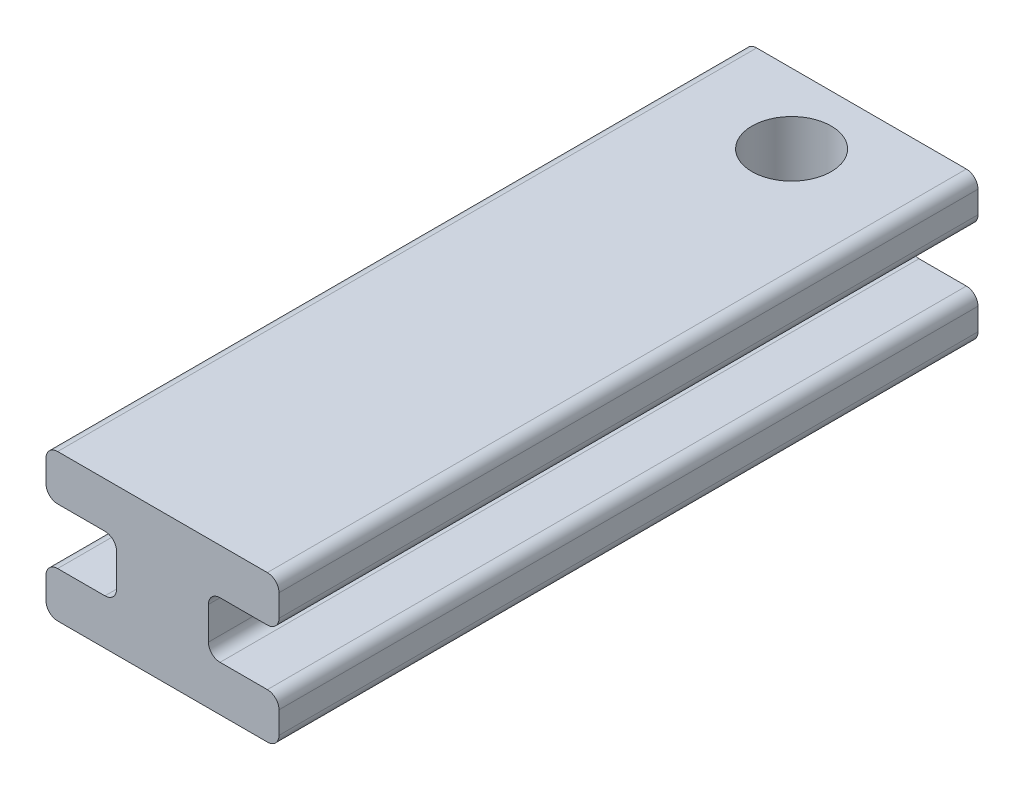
SolidWorks part; units mm, degrees
ref_plane "前视基准面" through (0, 0, 0) normal (0, 0, 1) x (1, 0, 0)
ref_plane "上视基准面" through (0, 0, 0) normal (0, 1, 0) x (1, 0, 0)
ref_plane "右视基准面" through (0, 0, 0) normal (1, 0, 0) x (0, 0, -1)
sketch "草图2" plane through (0, 0, 0) normal (0, 0, 1) x (1, 0, 0)
  line L0 (0, 41.904) -> (0, -45.9308) construction
  line L1 (-50.8385, 0) -> (47.0634, 0) construction
  line L2 (-5, 3.15) -> (5, 3.15)
  line L3 (5, 3.15) -> (5, 1.2)
  line L4 (5, 1.2) -> (1.97, 1.2)
  line L5 (1.97, 1.2) -> (1.97, 0)
  line L6 (5, -1.2) -> (1.97, -1.2)
  line L7 (5, -3.15) -> (5, -1.2)
  line L8 (-5, -3.15) -> (5, -3.15)
  line L9 (-5, -3.15) -> (-5, -1.2)
  line L10 (-5, -1.2) -> (-1.97, -1.2)
  line L11 (-1.97, 1.2) -> (-1.97, -1.2)
  line L12 (-5, 1.2) -> (-1.97, 1.2)
  line L13 (-5, 3.15) -> (-5, 1.2)
  line L14 (1.97, 0) -> (1.97, -1.2)
  point P15 (0, -3.15)
  point P21 (0, 3.15)
  dimension "D1" = 1.97
  dimension "D2" = 1.95
  dimension "D3" = 5
  dimension "D4" = 1.2
extrude "凸台-拉伸1" add sketch "草图2" along normal blind 30
fillet "圆角1" radius 0.5 12 edges at (5, -3.15, 15) (5, -1.2, 15) (5, 1.2, 15) (5, 3.15, 15) (1.97, -1.2, 15) (1.97, 1.2, 15) (-1.97, -1.2, 15) (-1.97, 1.2, 15) (-5, -3.15, 15) (-5, -1.2, 15) (-5, 3.15, 15) (-5, 1.2, 15)
sketch "草图3" plane through (0, 3.15, 0) normal (0, 1, 0) x (1, 0, 0)
  line L0 (0, 2.8806) -> (0, -30.6056) construction
  line L1 (4.5, 0) -> (-4.5, 0) construction
  circle A0 centre (0, -3) radius 1.7
  dimension "D1" = 3.4
  dimension "D2" = 3
extrude "切除-拉伸1" cut sketch "草图3" against normal through all
